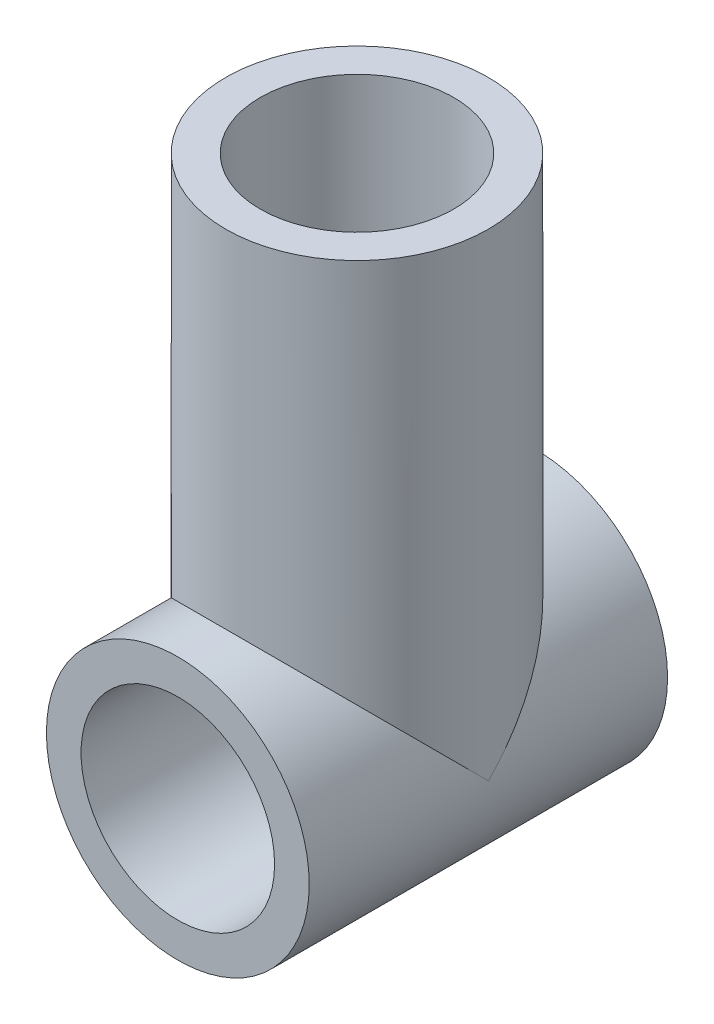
SolidWorks part; units mm, degrees
ref_plane "前视基准面" through (0, 0, 0) normal (0, 0, 1) x (1, 0, 0)
ref_plane "上视基准面" through (0, 0, 0) normal (0, 1, 0) x (1, 0, 0)
ref_plane "右视基准面" through (0, 0, 0) normal (1, 0, 0) x (0, 0, -1)
other "Configuration Table"
sketch "草图1" plane through (0, 0, 0) normal (0, 0, 1) x (1, 0, 0)
  circle A0 centre (0, 0) radius 11
extrude "凸台-拉伸1" add sketch "草图1" along normal blind 30
ref_point "点1"
ref_plane "基准面1" through (0, 0, 0) normal (0, 1, 0) x (1, 0, 0)
sketch "草图2" plane through (0, 0, 0) normal (0, 1, 0) x (1, 0, 0)
  line L0 (0, 0) -> (0, -30) construction
  line L1 (-11, -30) -> (11, -30) construction
  circle A0 centre (0, -15) radius 11
  circle A1 centre (0, -15) radius 8.1
extrude "凸台-拉伸2" add sketch "草图2" along normal blind 40
ref_plane "基准面2" through (0, 0, 0) normal (1, 0, 0) x (0, 0, -1)
sketch "草图3" plane through (0, 0, 30) normal (0, 0, 1) x (1, 0, 0)
  circle A0 centre (0, 0) radius 8.1
extrude "切除-拉伸1" cut sketch "草图3" against normal through all
sketch "草图4" plane through (0, 0, 0) normal (1, 0, 0) x (0, 0, -1)
  line L0 (12.1, 0) -> (-12.1, 0) construction
  line L2 (-30, 11) -> (-30, -11) construction
  line L3 (0, -11) -> (0, 11) construction
  line L7 (-4, 40) -> (-26, 40) construction
  circle A0 centre (-15, 0) radius 1.55 construction
  circle A4 centre (-15, 0) radius 1.55
  circle A6 centre (-15, 30) radius 1.55
  circle A7 centre (-15, 20) radius 1.55
  dimension "D1" = 10
  dimension "D2" = 10
  dimension "D3" = 15
  dimension "D6" = 15
sketch "草图5" plane through (0, 40, 0) normal (0, 1, 0) x (1, 0, 0)
  circle A0 centre (0, -15) radius 8.1
extrude "切除-拉伸3" cut sketch "草图5" against normal blind 40
